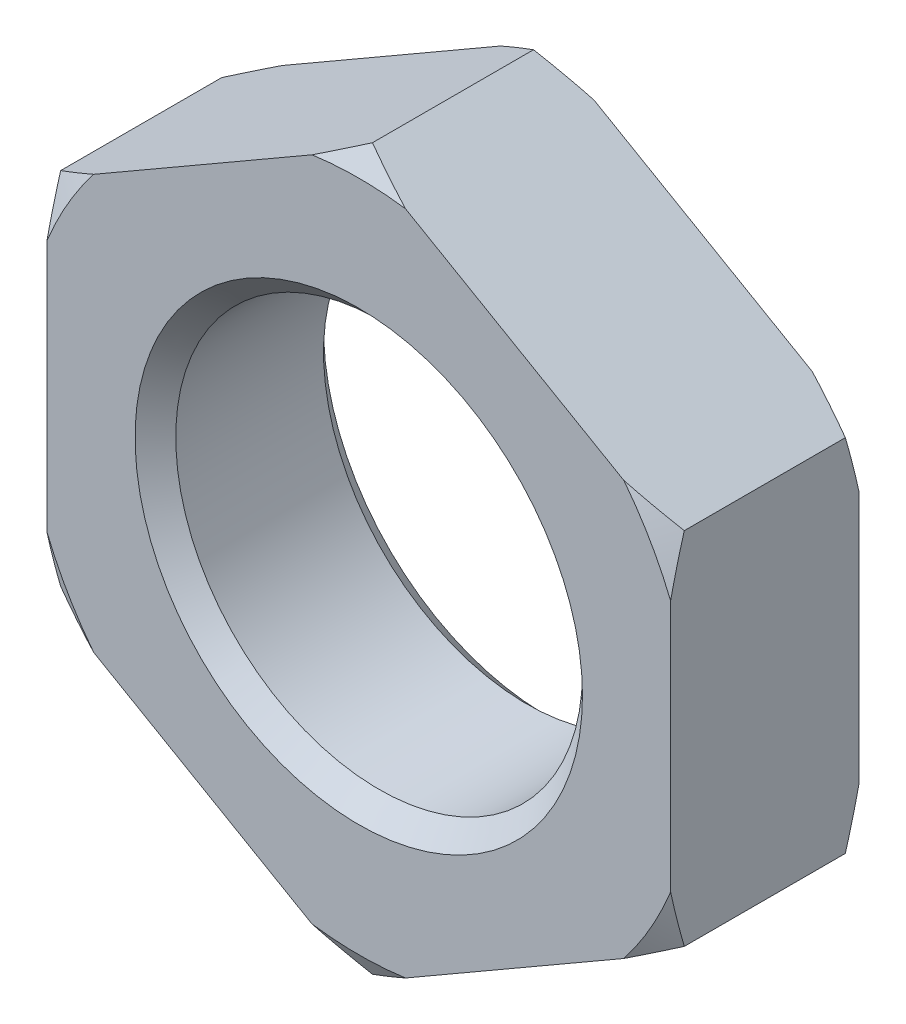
SolidWorks part; units mm, degrees
ref_plane "Front Plane" through (0, 0, 0) normal (0, 0, 1) x (1, 0, 0)
ref_plane "Top Plane" through (0, 0, 0) normal (0, 1, 0) x (1, 0, 0)
ref_plane "Right Plane" through (0, 0, 0) normal (1, 0, 0) x (0, 0, -1)
sketch "Sketch1" plane through (0, 0, 0) normal (0, 0, 1) x (1, 0, 0)
  line L1 (0, 26.5581) -> (-23, 13.2791)
  line L2 (-23, 13.2791) -> (-23, -13.2791)
  line L3 (-23, -13.2791) -> (0, -26.5581)
  line L4 (0, -26.5581) -> (23, -13.2791)
  line L5 (23, -13.2791) -> (23, 13.2791)
  line L6 (23, 13.2791) -> (0, 26.5581)
  circle A0 centre (0, 0) radius 23 construction
  circle A1 centre (0, 0) radius 15
  dimension "D2" = 30
  dimension "D1" = 46
extrude "Boss-Extrude1" add sketch "Sketch1" along normal mid plane 13.9
sketch "Sketch2" plane through (0, 0, 0) normal (1, 0, 0) x (0, 0, -1)
  line L0 (7.477, 0) -> (-8.5759, 0) construction
sketch "Sketch3" plane through (0, 0, 0) normal (1, 0, 0) x (0, 0, -1)
  line L0 (-6.95, 26.5581) -> (-6.95, 24.8081)
  line L1 (-6.95, 13.2791) -> (-6.95, 26.5581) construction
  line L2 (-6.95, 24.8081) -> (-5.9396, 26.5581)
  line L3 (-6.95, 26.5581) -> (6.95, 26.5581) construction
  line L4 (-5.9396, 26.5581) -> (-6.95, 26.5581)
  dimension "D1" = 1.75
  dimension "D2" = 30
revolve "Cut-Revolve1" cut sketch "Sketch3" angle 360 about L0
mirror "Mirror1" about plane through (0, 0, 0) normal (0, 0, 1) of "Cut-Revolve1"
chamfer "Chamfer1" distance 1.5 angle 45 2 edges at (15, 0, -6.95) (15, 0, 6.95)
